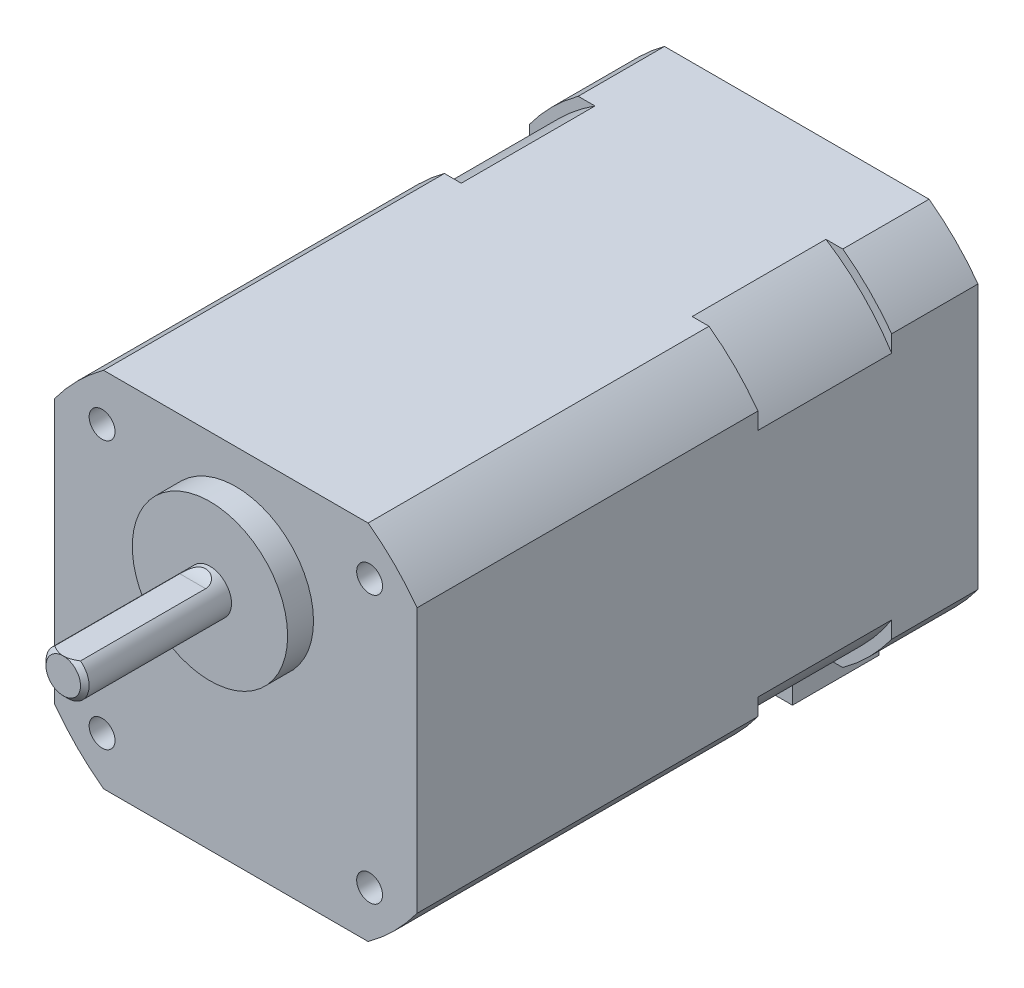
SolidWorks part; units mm, degrees
ref_plane "Front" through (0, 0, 0) normal (0, 0, 1) x (1, 0, 0)
ref_plane "Top" through (0, 0, 0) normal (0, 1, 0) x (1, 0, 0)
ref_plane "Right" through (0, 0, 0) normal (1, 0, 0) x (0, 0, -1)
sketch "Sketch1" plane through (0, 0, 0) normal (0, 0, 1) x (1, 0, 0)
  circle A0 centre (0, 0) radius 9
  dimension "D1" = 18
extrude "Extrude1" add sketch "Sketch1" along normal blind 3
sketch "Sketch2" plane through (0, 0, 3) normal (0, 0, 1) x (1, 0, 0)
  circle A0 centre (0, 0) radius 2.5
  dimension "D1" = 5
extrude "Extrude2" add sketch "Sketch2" along normal blind 17
sketch "Sketch3" plane through (0, 0, 0) normal (1, 0, 0) x (0, 0, -1)
  line L0 (-20, 0) -> (0, 0) construction
  line L1 (-20, 2.5) -> (-20, -2.5) construction
  line L2 (-20, 2) -> (-5, 2)
  line L3 (-3.5, 2.5) -> (-3.5, 0) construction
  line L4 (-3, 2.5) -> (-20, 2.5) construction
  line L5 (-20, 2) -> (-20, 7)
  line L6 (-20, 7) -> (-5, 7)
  line L7 (-3.5, 2.5) -> (-20, 2.5)
  circle A0 centre (-5, 4.5) radius 2.5
  dimension "D3" = 5
  dimension "D1" = 2
  dimension "D2" = 15
extrude "Extrude3" cut sketch "Sketch3" against normal mid plane 5 contours A0 L7 L5 L2 | L7 A0
chamfer "Chamfer1" distance 0.5 angle 45 1 edges at (0, -2.5, 20)
sketch "Sketch4" plane through (0, 0, 0) normal (0, 0, -1) x (-1, 0, 0)
  line L0 (0, 0) -> (0, -8) construction
  line L1 (-21, -29) -> (21, -29)
  line L2 (-21, -29) -> (-21, 13)
  line L3 (-21, 13) -> (21, 13)
  line L4 (21, -29) -> (21, 13)
  line L5 (-21, -29) -> (21, 13) construction
  line L6 (-21, 13) -> (21, -29) construction
  circle A0 centre (0, -8) radius 26
  point P0 (0, -8)
  dimension "D4" = 52
  dimension "D1" = 8
  dimension "D2" = 42
  dimension "D3" = 42
extrude "Extrude4" add sketch "Sketch4" along normal blind 32.2 contours L4 A0 L3 L2 L1 M4 | M4
sketch "Sketch5" plane through (0, 0, -32.2) normal (0, 0, -1) x (-1, 0, 0)
  line L4 (21, -23.3297) -> (21, 7.3297)
  line L5 (15.3297, 13) -> (-15.3297, 13)
  line L6 (-21, 7.3297) -> (-21, -23.3297)
  line L7 (-15.3297, -29) -> (15.3297, -29)
  line L8 (21, -23.3297) -> (21, 7.3297)
  line L9 (15.3297, 13) -> (-15.3297, 13)
  line L10 (-21, 7.3297) -> (-21, -23.3297)
  line L11 (-15.3297, -29) -> (15.3297, -29)
  arc A4 (21, 7.3297) -> (15.3297, 13) centre (0, -8) ccw
  arc A5 (-15.3297, 13) -> (-21, 7.3297) centre (0, -8) ccw
  arc A6 (-21, -23.3297) -> (-15.3297, -29) centre (0, -8) ccw
  arc A7 (15.3297, -29) -> (21, -23.3297) centre (0, -8) ccw
  arc A8 (21, 7.3297) -> (15.3297, 13) centre (0, -8) ccw
  arc A9 (-15.3297, 13) -> (-21, 7.3297) centre (0, -8) ccw
  arc A10 (-21, -23.3297) -> (-15.3297, -29) centre (0, -8) ccw
  arc A11 (15.3297, -29) -> (21, -23.3297) centre (0, -8) ccw
  dimension "D1" = 0
extrude "Extrude5" add sketch "Sketch5" along normal blind 7.3
sketch "Sketch6" plane through (0, 0, -39.5) normal (0, 0, -1) x (-1, 0, 0)
  line L4 (21, -23.3297) -> (21, 7.3297)
  line L5 (15.3297, 13) -> (-15.3297, 13)
  line L6 (-21, 7.3297) -> (-21, -23.3297)
  line L7 (-15.3297, -29) -> (15.3297, -29)
  line L8 (21, -23.3297) -> (21, 7.3297)
  line L9 (15.3297, 13) -> (-15.3297, 13)
  line L10 (-21, 7.3297) -> (-21, -23.3297)
  line L11 (-15.3297, -29) -> (15.3297, -29)
  circle A0 centre (0, -8) radius 24.9
  arc A4 (15.3297, -29) -> (21, -23.3297) centre (0, -8) ccw
  arc A5 (21, 7.3297) -> (15.3297, 13) centre (0, -8) ccw
  arc A6 (-15.3297, 13) -> (-21, 7.3297) centre (0, -8) ccw
  arc A7 (-21, -23.3297) -> (-15.3297, -29) centre (0, -8) ccw
  arc A8 (15.3297, -29) -> (21, -23.3297) centre (0, -8) ccw
  arc A9 (21, 7.3297) -> (15.3297, 13) centre (0, -8) ccw
  arc A10 (-15.3297, 13) -> (-21, 7.3297) centre (0, -8) ccw
  arc A11 (-21, -23.3297) -> (-15.3297, -29) centre (0, -8) ccw
  dimension "D2" = 49.8
  dimension "D1" = 0
extrude "Extrude6" add sketch "Sketch6" along normal blind 15.5 contours L8 A0 L9 L10 L11
sketch "Sketch7" plane through (0, 0, -55) normal (0, 0, -1) x (-1, 0, 0)
  line L0 (0, 0) -> (0, -8) construction
  line L1 (-21, -29) -> (21, -29)
  line L2 (-21, -29) -> (-21, 13)
  line L3 (-21, 13) -> (21, 13)
  line L4 (21, -29) -> (21, 13)
  line L5 (-21, -29) -> (21, 13) construction
  line L6 (-21, 13) -> (21, -29) construction
  circle A0 centre (0, -8) radius 26
  point P0 (0, -8)
  dimension "D4" = 52
  dimension "D1" = 8
  dimension "D2" = 42
  dimension "D3" = 42
extrude "Extrude7" add sketch "Sketch7" along normal blind 10
sketch "Sketch9" plane through (0, -29, 0) normal (0, -1, 0) x (1, 0, 0)
  line L0 (15.3297, -65) -> (-15.3297, -65) construction
  line L1 (-9.5, -65) -> (9.5, -65)
  line L2 (-9.5, -65) -> (-9.5, -55)
  line L3 (-9.5, -55) -> (9.5, -55)
  line L4 (9.5, -65) -> (9.5, -55)
  dimension "D1" = 19
  dimension "D2" = 10
  dimension "D3" = 9.5
extrude "Extrude8" add sketch "Sketch9" along normal blind 6.7
sketch "Sketch10" plane through (0, 0, 0) normal (0, 0, 1) x (1, 0, 0)
  line L0 (0, 0) -> (0, -18.8658) construction
  line L1 (-15.5, -23.5) -> (15.5, -23.5) construction
  line L2 (-15.5, -23.5) -> (-15.5, 7.5) construction
  line L3 (-15.5, 7.5) -> (15.5, 7.5) construction
  line L4 (15.5, -23.5) -> (15.5, 7.5) construction
  line L5 (-15.5, -23.5) -> (15.5, 7.5) construction
  line L6 (-15.5, 7.5) -> (15.5, -23.5) construction
  circle A0 centre (-15.5, 7.5) radius 1.5
  circle A1 centre (15.5, 7.5) radius 1.5
  circle A2 centre (-15.5, -23.5) radius 1.5
  circle A3 centre (15.5, -23.5) radius 1.5
  point P0 (0, -8)
  dimension "D4" = 3
  dimension "D1" = 31
  dimension "D2" = 31
  dimension "D3" = 8
extrude "Extrude9" cut sketch "Sketch10" against normal blind 7
